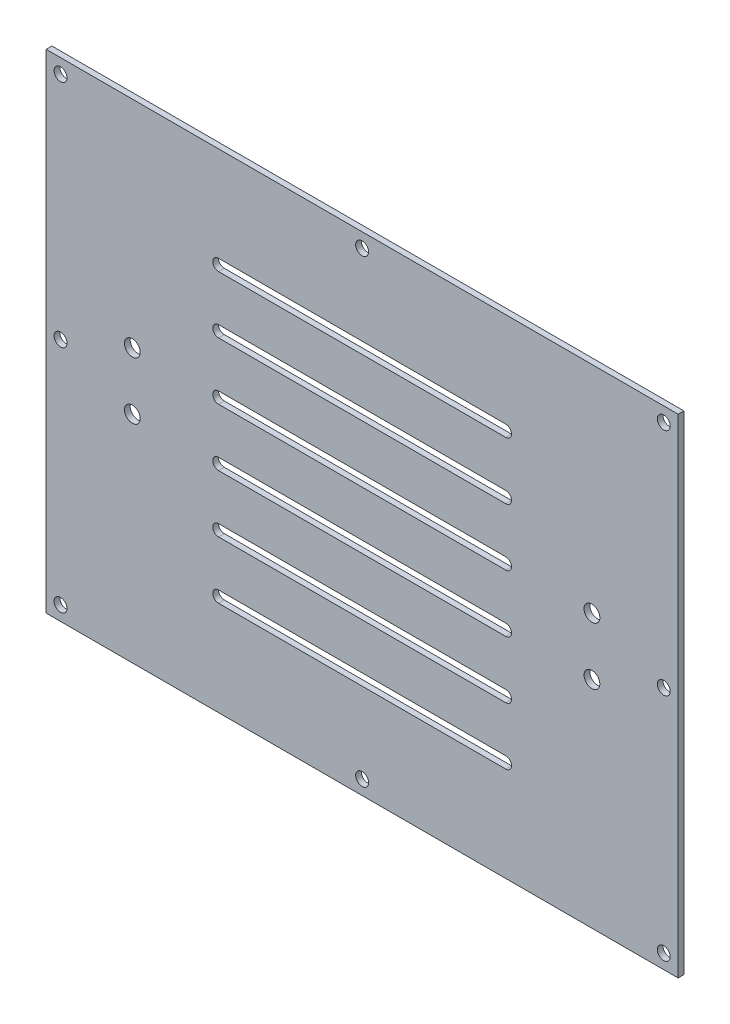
SolidWorks part; units mm, degrees
ref_plane "前基準面" through (0, 0, 0) normal (0, 0, 1) x (1, 0, 0)
ref_plane "上基準面" through (0, 0, 0) normal (0, 1, 0) x (1, 0, 0)
ref_plane "右基準面" through (0, 0, 0) normal (1, 0, 0) x (0, 0, -1)
sketch "草圖1" plane through (0, 0, 0) normal (0, 0, 1) x (1, 0, 0)
  line L1 (0, 0) -> (220, 0)
  line L2 (0, 0) -> (0, -170)
  line L3 (0, -170) -> (220, -170)
  line L4 (220, 0) -> (220, -170)
  dimension "D1" = 220
  dimension "D2" = 170
extrude "填料-伸長1" add sketch "草圖1" along normal blind 2
sketch "草圖2" plane through (0, 0, 2) normal (0, 0, 1) x (1, 0, 0)
  line L0 (60, -35) -> (160, -35) construction
  line L1 (60, -33) -> (160, -33)
  line L2 (60, -37) -> (160, -37)
  line L3 (220, 0) -> (0, 0) construction
  line L25 (0, 0) -> (0, -170) construction
  arc A0 (60, -33) -> (60, -37) centre (60, -35) ccw
  arc A1 (160, -37) -> (160, -33) centre (160, -35) ccw
  point P2 (110, -35)
  dimension "D1" = 2
  dimension "D2" = 100
  dimension "D3" = 35
  dimension "D5" = 110
extrude "除料-伸長1" cut sketch "草圖2" against normal up to next
sketch "草圖3" plane through (0, 0, 2) normal (0, 0, 1) x (1, 0, 0)
  line L0 (0, 0) -> (0, -170) construction
  line L1 (220, 0) -> (0, 0) construction
  line L2 (220, -170) -> (220, 0) construction
  line L3 (0, -170) -> (220, -170) construction
  circle A0 centre (5, -5) radius 2.25
  circle A1 centre (215, -5) radius 2.25
  circle A2 centre (5, -165) radius 2.25
  circle A3 centre (215, -165) radius 2.25
  circle A4 centre (5, -85) radius 2.25
  circle A5 centre (215, -85) radius 2.25
  circle A6 centre (110, -5) radius 2.25
  circle A7 centre (110, -165) radius 2.25
  dimension "D1" = 4.5
  dimension "D2" = 4.5
  dimension "D3" = 4.5
  dimension "D4" = 4.5
  dimension "D11" = 4.5
  dimension "D18" = 4.5
  dimension "D20" = 4.5
  dimension "D22" = 4.5
  dimension "D5" = 5
  dimension "D6" = 5
  dimension "D7" = 5
  dimension "D8" = 5
  dimension "D9" = 5
  dimension "D10" = 80
  dimension "D12" = 5
  dimension "D13" = 5
  dimension "D14" = 5
  dimension "D15" = 5
  dimension "D16" = 5
  dimension "D17" = 80
  dimension "D19" = 105
  dimension "D21" = 105
extrude "除料-伸長2" cut sketch "草圖3" against normal blind 2
pattern_linear "直線複製排列1" count 6 spacing 20 along (0, -1, 0) of "除料-伸長1"
sketch "草圖4" plane through (0, 0, 2) normal (0, 0, 1) x (1, 0, 0)
  line L0 (0, 0) -> (0, -170) construction
  line L1 (220, 0) -> (0, 0) construction
  line L2 (220, -170) -> (220, 0) construction
  circle A0 centre (30, -75) radius 2.75
  circle A1 centre (30, -95) radius 2.75
  circle A2 centre (190, -75) radius 2.75
  circle A3 centre (190, -95) radius 2.75
  dimension "D3" = 5.5
  dimension "D4" = 5.5
  dimension "D5" = 5.5
  dimension "D6" = 5.5
  dimension "D7" = 20
  dimension "D1" = 30
  dimension "D2" = 30
  dimension "D8" = 20
  dimension "D9" = 75
  dimension "D10" = 75
  dimension "D11" = 30
extrude "除料-伸長3" cut sketch "草圖4" against normal up to next
